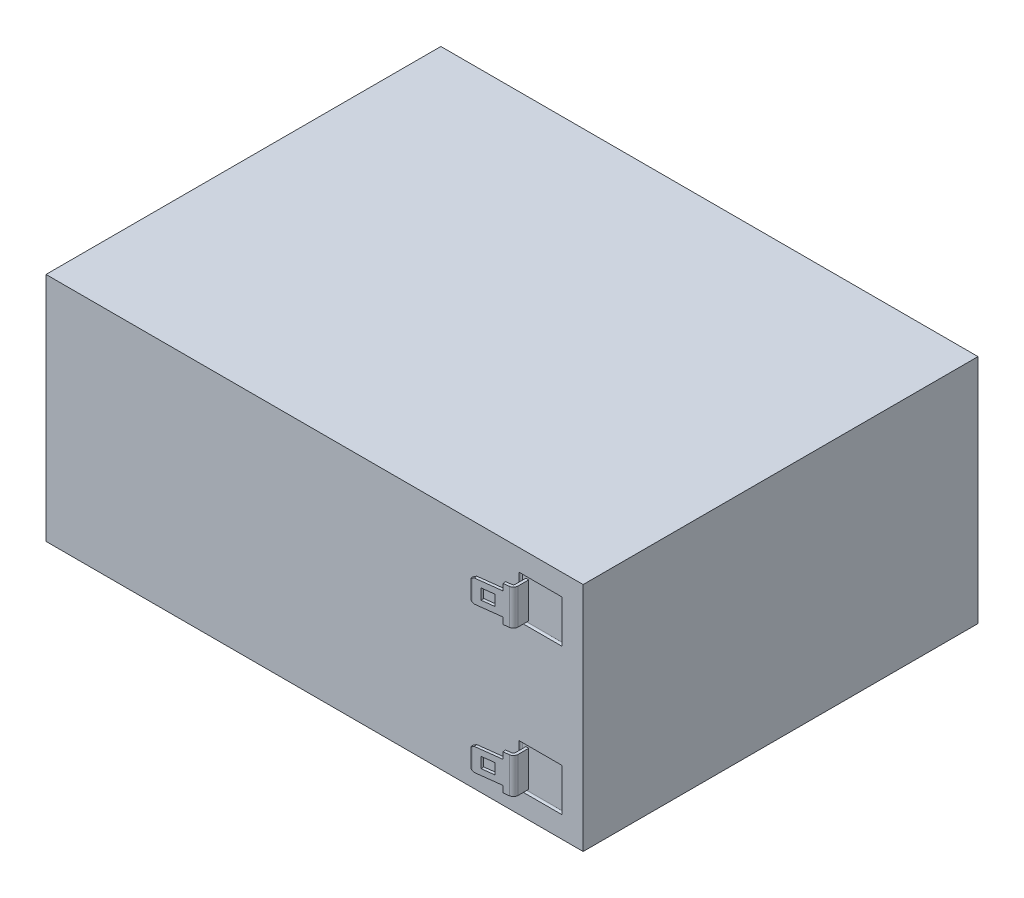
SolidWorks part; units mm, degrees
ref_plane "Plan de face" through (0, 0, 0) normal (0, 0, 1) x (1, 0, 0)
ref_plane "Plan de dessus" through (0, 0, 0) normal (0, 1, 0) x (1, 0, 0)
ref_plane "Plan de droite" through (0, 0, 0) normal (1, 0, 0) x (0, 0, -1)
sketch "Esquisse1" plane through (0, 0, 0) normal (0, 0, 1) x (1, 0, 0)
  line L1 (-151, 0) -> (0, 0)
  line L2 (-151, 0) -> (-151, -65)
  line L3 (-151, -65) -> (0, -65)
  line L4 (0, 0) -> (0, -65)
  line L6 (-75.5, 99.6) -> (-75.5, -31.9685) construction
  dimension "D1" = 151
  dimension "D2" = 65
  dimension "D3" = 75.5
extrude "Extrusion1" add sketch "Esquisse1" along normal blind 111
sketch "Esquisse2" plane through (0, 0, 111) normal (0, 0, 1) x (1, 0, 0)
  line L0 (0, 0) -> (-151, 0) construction
  line L1 (-6, -6) -> (-18, -6)
  line L2 (-6, -6) -> (-6, -18)
  line L3 (-6, -18) -> (-18, -18)
  line L4 (-18, -6) -> (-18, -18)
  line L5 (0, -65) -> (0, 0) construction
  dimension "D1" = 12
  dimension "D2" = 12
  dimension "D3" = 6
  dimension "D4" = 6
extrude "Enlèv. mat.-Extru.1" cut sketch "Esquisse2" against normal blind 0.5
ref_plane "Plan1" through (0, -12, 0) normal (0, -1, 0) x (1, 0, 0)
fillet "Congé1" radius 0.5 4 edges at (-12, -18, 110.5) (-18, -12, 110.5) (-12, -6, 110.5) (-6, -12, 110.5)
sketch "Esquisse3" plane through (0, -12, 0) normal (0, -1, 0) x (1, 0, 0)
  line L0 (-15.8, 110.5) -> (-15.8, 113.5)
  line L1 (-16.9403, 114.7902) -> (-26.3297, 115.9521)
  line L2 (-26.7646, 115.613) -> (-26.7671, 115.5931)
  line L3 (-26.4279, 115.1582) -> (-17.0386, 113.9962)
  line L4 (-16.6, 113.5) -> (-16.6, 110.5)
  line L5 (-16.6, 110.5) -> (-15.8, 110.5)
  line L6 (-6.5, 110.5) -> (-17.5, 110.5) construction
  line L7 (-151, 0) -> (0, 0) construction
  line L8 (0, 111) -> (0, 0) construction
  arc A0 (-17.0386, 113.9962) -> (-16.6, 113.5) centre (-17.1, 113.5) cw
  arc A1 (-15.8, 113.5) -> (-16.9403, 114.7902) centre (-17.1, 113.5) ccw
  arc A2 (-26.3297, 115.9521) -> (-26.7646, 115.613) centre (-26.3776, 115.5651) ccw
  arc A3 (-26.7671, 115.5931) -> (-26.4279, 115.1582) centre (-26.38, 115.5452) ccw
  point P18 (-15.8, 114.649)
  point P19 (-26.7167, 116)
  point P22 (-26.815, 115.2061)
  dimension "D5" = 0.5
  dimension "D6" = 1.3
  dimension "D9" = 0.39
  dimension "D1" = 0.8
  dimension "D2" = 0.8
  dimension "D3" = 116
  dimension "D4" = 11
  dimension "D7" = 3
  dimension "D8" = 15.8
extrude "Extrusion2" add sketch "Esquisse3" along normal mid plane 10
sketch "Esquisse4" plane through (13.7357, 0, 110.994) normal (0.1228, 0, 0.9924) x (0.9924, 0, -0.1228)
  line L0 (-41.745, -12) -> (-28.1782, -12) construction
  line L1 (-40.761, -9.4024) -> (-39.761, -8.825)
  line L2 (-39.761, -8.825) -> (-32.511, -8.825)
  line L3 (-32.511, -8.825) -> (-32.511, -7)
  line L4 (-32.511, -7) -> (-40.761, -7)
  line L5 (-40.761, -7) -> (-40.761, -9.4024)
  line L6 (-40.761, -17) -> (-40.761, -14.5976)
  line L7 (-32.511, -17) -> (-40.761, -17)
  line L8 (-32.511, -15.175) -> (-32.511, -17)
  line L9 (-39.761, -15.175) -> (-32.511, -15.175)
  line L10 (-40.761, -14.5976) -> (-39.761, -15.175)
  line L11 (-38.011, -10.5) -> (-34.511, -10.5)
  line L19 (-38.011, -10.5) -> (-38.011, -13.5)
  line L20 (-38.011, -13.5) -> (-34.511, -13.5)
  line L21 (-34.511, -10.5) -> (-34.511, -13.5)
  dimension "D5" = 6.35
  dimension "D6" = 30
  dimension "D7" = 1
  dimension "D8" = 3.5
  dimension "D9" = 3
  dimension "D10" = 1.5
  dimension "D11" = 2
extrude "Enlèv. mat.-Extru.2" cut sketch "Esquisse4" against normal up to next
ref_plane "Plan2" through (0, -32.5, 0) normal (0, 1, 0) x (-1, 0, 0)
mirror "Symétrie1" about plane through (0, -32.5, 0) normal (0, 1, 0) of "Enlèv. mat.-Extru.2", "Extrusion2", "Congé1", "Enlèv. mat.-Extru.1"
ref_plane "Plan3" through (-75.5, 0, 0) normal (1, 0, 0) x (0, 0, -1)
